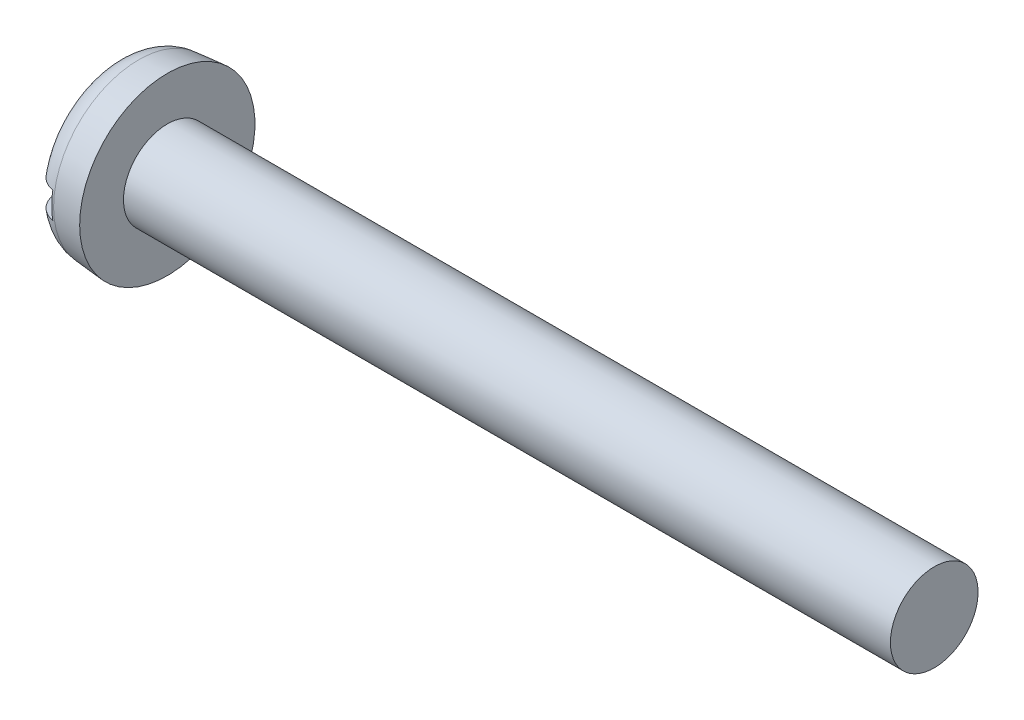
SolidWorks part; units mm, degrees
ref_plane "Plane1" through (0, 0, 0) normal (0, 0, 1) x (1, 0, 0)
ref_plane "Plane2" through (0, 0, 0) normal (0, 1, 0) x (1, 0, 0)
ref_plane "Plane3" through (0, 0, 0) normal (1, 0, 0) x (0, 0, -1)
sketch "BodySke" plane through (0, 0, 0) normal (0, 0, 1) x (1, 0, 0)
  line L0 (2.4, 2) -> (2.4, 4)
  line L1 (0, 0) -> (0, 3.79)
  line L2 (-25.4, 0) -> (127, 0) construction
  line L3 (37.4, 0) -> (0, 0)
  line L4 (2.4, 2) -> (37.4, 2)
  line L5 (37.4, 2) -> (37.4, 0)
  line L6 (0, 3.79) -> (2.4, 4)
  line L9 (3.1, 3.5875) -> (3.1, -5.9375) construction
  line L10 (2.4, 6.35) -> (2.4, -3.175) construction
  dimension "Head_ht" = 2.4
  dimension "Diameter" = 4
  dimension "Length" = 35
  dimension "Head_dia" = 8
  dimension "Advance" = 0.7
  dimension "Thread_nom" = 35
  dimension "Head_side_angle" = 5
revolve "Base-Revolve" add sketch "BodySke"
fillet "Fillet1" [suppressed] radius 0.2
fillet "Fillet2" radius 1.2 1 edges at (0, 0, 3.79)
sketch "Sketch2" plane through (0, 0, 0) normal (1, 0, 0) x (0, 0, -1)
  line L0 (4, -0.6) -> (-4, -0.6)
  line L1 (4, -0.6) -> (4, 0.6)
  line L2 (-4, 0.6) -> (4, 0.6)
  line L3 (-4, 0.6) -> (-4, -0.6)
  dimension "D1" = 8
  dimension "D2" = 4
  dimension "Slot_width" = 1.2
  dimension "D3" = 0.6
extrude "Slot" cut sketch "Sketch2" along normal blind 1
sketch "ThdSchSke" plane through (0, 0, 0) normal (0, 0, 1) x (1, 0, 0)
  line L0 (3.8, -1.61) -> (3.5269, -2)
  line L1 (3.8, -1.61) -> (4.0731, -2)
  line L2 (4.0731, -2) -> (4.0731, -2.5)
  line L3 (-3.175, 0) -> (5.1513, 0) construction
  line L5 (4.0731, -2.5) -> (3.5269, -2.5)
  line L6 (3.5269, -2.5) -> (3.5269, -2)
  dimension "Thread_minor" = 3.22
  dimension "Diameter" = 4
  dimension "Start" = 3.8
  dimension "SideAngle" = 55
  dimension "VeeAngle" = 70
  dimension "Overcut" = 5
revolve "ThreadSchematic" [suppressed] cut sketch "ThdSchSke" angle 360 about L3
pattern_linear "ThdSchPat" [suppressed]
equation "\"D1@Sketch2\" = \"Head_dia@BodySke\""
equation "\"D2@Sketch2\" = \"D1@Sketch2\" / 2"
equation "\"D3@Sketch2\" = \"Slot_width@Sketch2\" / 2"
equation "\"Thread_length@ThreadCosmetic\" = ((sgn( (\"Length@BodySke\" - \"Advance@BodySke\" * 2.0 ) - \"Thread_nom@BodySke\" )-1)*( (\"Length@BodySke\" - \"Advance@BodySke\"  * 2.0) - \"Thread_nom@BodySke\" ))/-2+ \"Thread_"
equation "\"Thread_minor@ThdSchSke\" = \"Thread_minor@ThreadCosmetic\""
equation "\"Diameter@ThdSchSke\" = \"Diameter@BodySke\""
equation "\"Overcut@ThdSchSke\" = \"Diameter@BodySke\" * 1.25"
equation "\"Start@ThdSchSke\" = \"Head_ht@BodySke\" + \"Length@BodySke\" - \"Thread_length@ThreadCosmetic\"  '---Non-countersunk---"
equation "\"Num_threads@ThdSchPat\" = int( \"Thread_length@ThreadCosmetic\" / \"Advance@BodySke\" + 0.999 )  + 1"
equation "\"Advance@ThdSchPat\" = \"Thread_length@ThreadCosmetic\" /  (\"Num_threads@ThdSchPat\" - 1) 'relax it"
